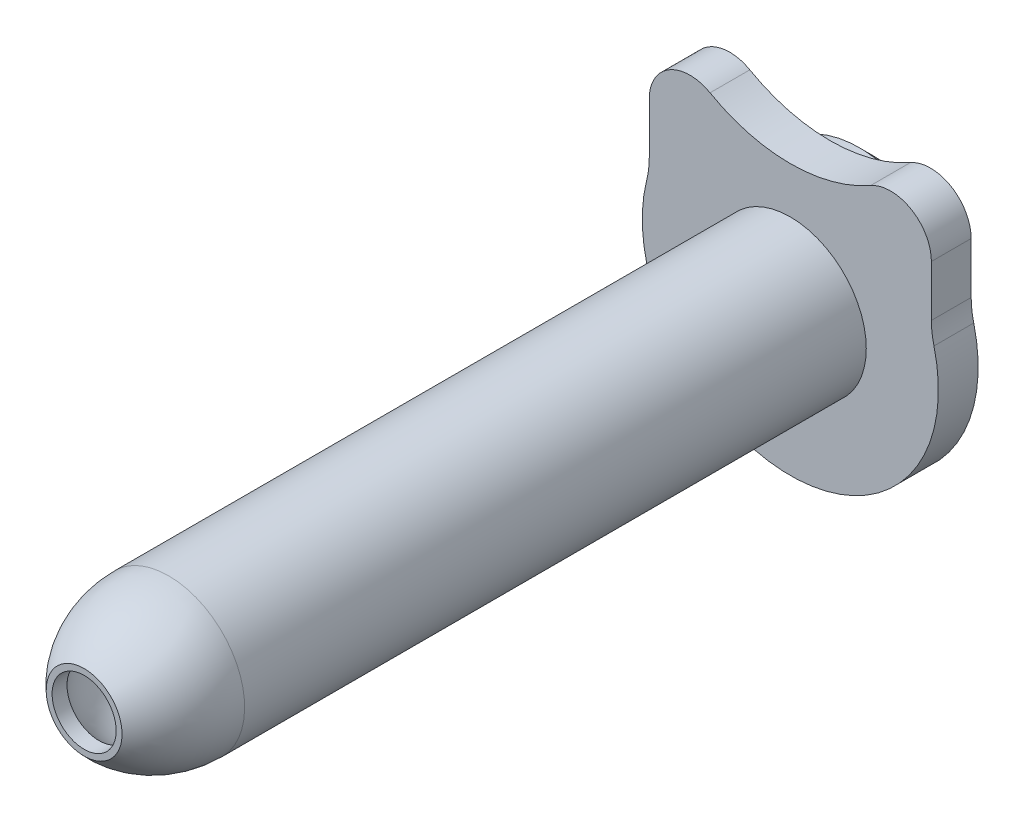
SolidWorks part; units mm, degrees
ref_plane "Front Plane" through (0, 0, 0) normal (0, 0, 1) x (1, 0, 0)
ref_plane "Top Plane" through (0, 0, 0) normal (0, 1, 0) x (1, 0, 0)
ref_plane "Right Plane" through (0, 0, 0) normal (1, 0, 0) x (0, 0, -1)
sketch "Sketch2" plane through (0, 0, 0) normal (1, 0, 0) x (0, 0, -1)
  line L0 (0, 0) -> (-44.323, 0) construction
  line L1 (0, 0) -> (0, 4.2672) construction
  line L2 (0, 4.2672) -> (-39.5732, 4.2672)
  line L3 (-44.323, 0) -> (-44.323, 2.1317)
  line L4 (0, 4.2672) -> (0, 0)
  line L5 (0, 0) -> (-44.323, 0)
  arc A0 (-39.5732, 4.2672) -> (-44.323, 2.1317) centre (-39.5732, -2.0828) ccw
  dimension "D3" = 4.7498
  dimension "D4" = 12.7
  dimension "D1" = 44.323
  dimension "D2" = 4.2672
revolve "Revolve2" add sketch "Sketch2" angle 360 about L5
ref_plane "Plane1" through (0, 0, 4.6482) normal (0, 0, -1) x (-1, 0, 0)
shell "Shell2" thickness 0.8382
sketch "Sketch7" plane through (0, 0, 43.4848) normal (0, 0, -1) x (-1, 0, 0)
  circle A1 centre (0, 0) radius 1.8004
  circle A2 centre (0, 0) radius 1.8004
  dimension "D1" = 0
extrude "Cut-Extrude2" cut sketch "Sketch7" against normal blind 39.3192
sketch "Sketch3" plane through (0, 0, 4.6482) normal (0, 0, -1) x (-1, 0, 0)
  line L0 (0, 0) -> (0, 18.083) construction
  line L1 (10.7365, 6.858) -> (-9.0604, 6.858) construction
  line L3 (-7.9248, 3.193) -> (-7.9248, 6.0597)
  line L4 (7.9248, 6.0597) -> (7.9248, 3.193)
  arc A0 (-4.511, 8.0482) -> (4.511, 8.0482) centre (0, 16.002) ccw
  arc A1 (-8.0693, 2.0207) -> (8.0693, 2.0207) centre (0, 0) ccw
  arc A2 (7.9248, 6.0597) -> (4.511, 8.0482) centre (5.6388, 6.0597) ccw
  arc A3 (-7.9248, 6.0597) -> (-4.511, 8.0482) centre (-5.6388, 6.0597) cw
  arc A4 (-7.9248, 3.193) -> (-8.0693, 2.0207) centre (-12.7508, 3.193) cw
  arc A5 (8.0693, 2.0207) -> (7.9248, 3.193) centre (12.7508, 3.193) cw
  dimension "D2" = 18.288
  dimension "D3" = 16.637
  dimension "D5" = 4.572
  dimension "D4" = 4.826
  dimension "D1" = 6.858
extrude "Boss-Extrude1" add sketch "Sketch3" along normal blind 2.2352
sketch "Sketch4" plane through (0, 0, 0) normal (1, 0, 0) x (0, 0, -1)
  line L0 (-2.413, 5.6896) -> (0, 5.6896)
  line L2 (0, 5.6896) -> (0, 4.2672)
  line L3 (0, 4.2672) -> (-2.413, 4.2672)
  line L4 (-2.413, 6.0597) -> (-2.413, 3.193) construction
  line L5 (-2.413, -4.2672) -> (-2.413, 4.2672) construction
  line L6 (-2.413, 4.2672) -> (-2.413, 5.6896)
  line L7 (-11.7985, 0) -> (2.329, 0) construction
  dimension "D1" = 5.6896
sketch "Sketch5" plane through (0, 0, 2.413) normal (0, 0, -1) x (-1, 0, 0)
  circle A0 centre (0, 0) radius 5.6896
  dimension "D1" = 11.3792
revolve "Revolve3" add sketch "Sketch4" angle 360 about L7
chamfer "Chamfer1" distance 0.762 angle 45 1 edges at (5.6896, 0, 0)
sketch "Sketch6" plane through (0, 0, 0) normal (0, 0, -1) x (-1, 0, 0)
  circle A0 centre (0, 0) radius 3.429
  dimension "D1" = 6.858
sketch "Sketch10" plane through (0, 0, 2.413) normal (0, 0, -1) x (-1, 0, 0)
  circle A0 centre (0, 0) radius 3.429 construction
  circle A1 centre (0, 0) radius 3.429
extrude "Cut-Extrude4" cut sketch "Sketch10" against normal blind 37.2872
